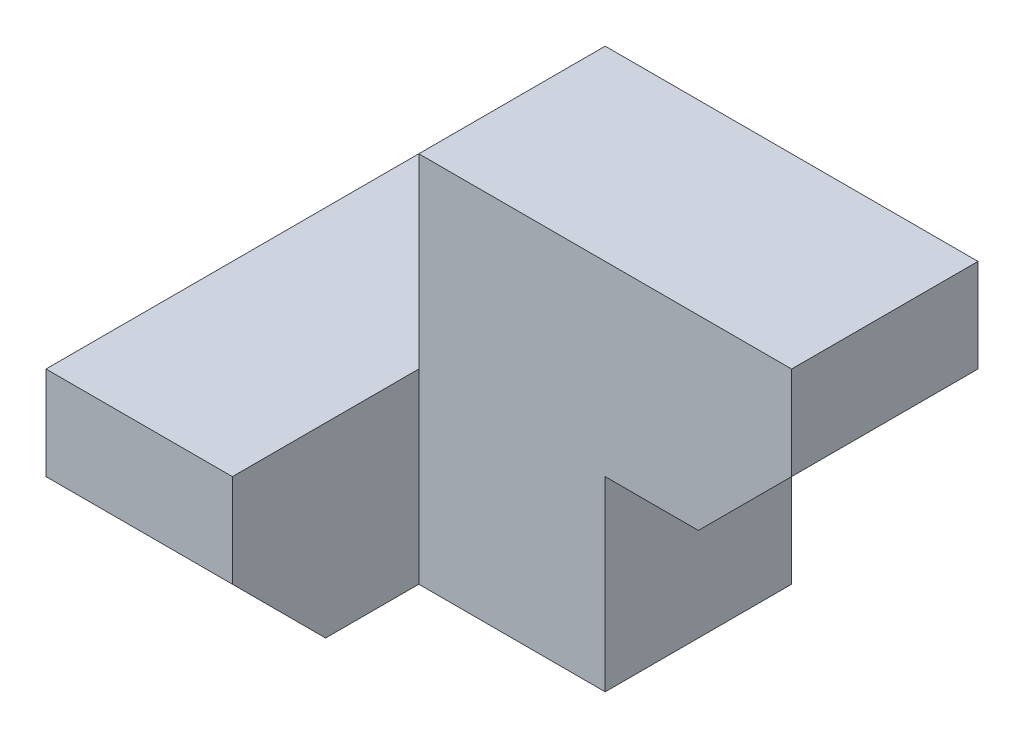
SolidWorks part; units mm, degrees
ref_plane "Plan de face" through (0, 0, 0) normal (0, 0, 1) x (1, 0, 0)
ref_plane "Plan de dessus" through (0, 0, 0) normal (0, 1, 0) x (1, 0, 0)
ref_plane "Plan de droite" through (0, 0, 0) normal (1, 0, 0) x (0, 0, -1)
sketch "Esquisse1" plane through (0, 0, 0) normal (0, 0, 1) x (1, 0, 0)
  line L0 (0, 0) -> (20, 0)
  line L1 (20, 0) -> (20, 10)
  line L2 (20, 10) -> (30, 10)
  line L3 (30, 10) -> (30, 20)
  line L4 (30, 20) -> (10, 20)
  line L5 (10, 20) -> (10, 10)
  line L6 (10, 10) -> (0, 10)
  line L7 (0, 10) -> (0, 0)
  dimension "D1" = 20
  dimension "D2" = 20
  dimension "D3" = 10
  dimension "D4" = 10
  dimension "D5" = 10
  dimension "D6" = 10
extrude "Boss.-Extru.1" add sketch "Esquisse1" along normal blind 10
sketch "Esquisse2" plane through (0, 0, 10) normal (0, 0, 1) x (1, 0, 0)
  line L1 (10, 10) -> (0, 10)
  line L2 (10, 10) -> (10, 0)
  line L3 (10, 0) -> (0, 0)
  line L4 (0, 10) -> (0, 0)
extrude "Boss.-Extru.2" add sketch "Esquisse2" along normal blind 10
chamfer "Chanfrein1" distance 5 angle 45 2 edges at (30, 10, 5) (5, 0, 20)
